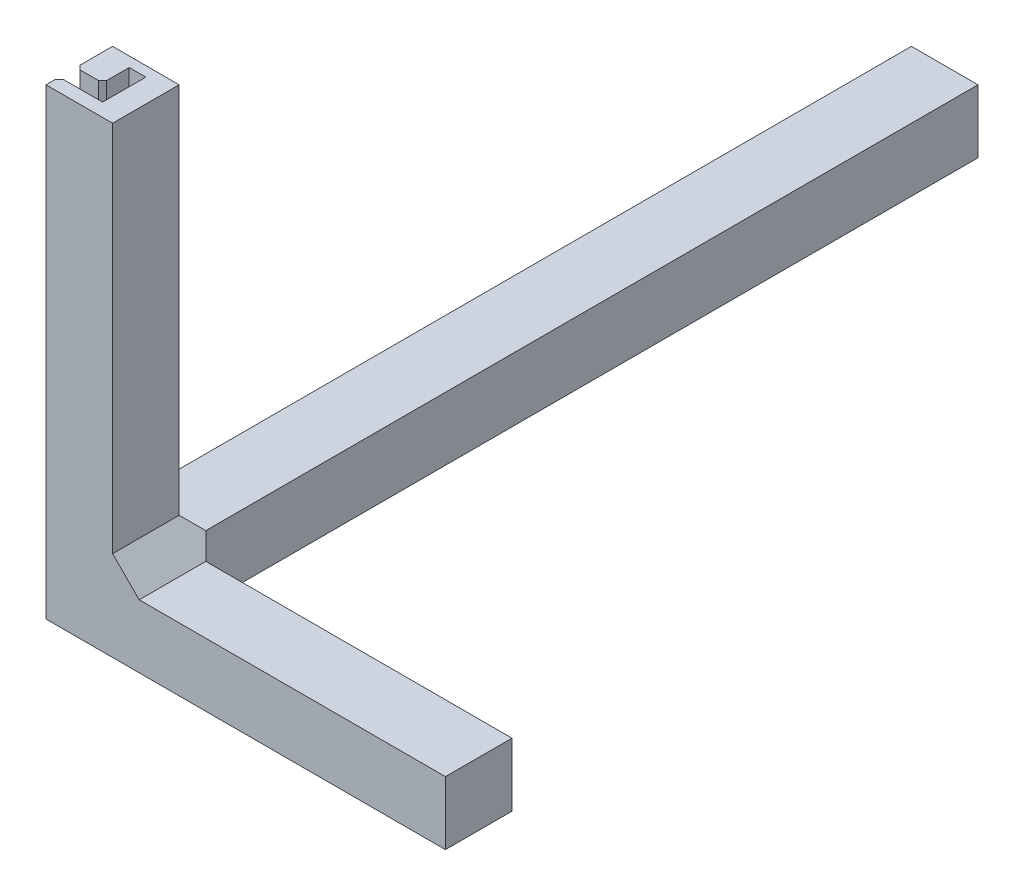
SolidWorks part; units mm, degrees
ref_plane "Plan de face" through (0, 0, 0) normal (0, 0, 1) x (1, 0, 0)
ref_plane "Plan de dessus" through (0, 0, 0) normal (0, 1, 0) x (1, 0, 0)
ref_plane "Plan de droite" through (0, 0, 0) normal (1, 0, 0) x (0, 0, -1)
sketch "Esquisse1" plane through (0, 0, 0) normal (1, 0, 0) x (0, 0, -1)
  line L0 (0, 0) -> (0, 70)
  line L1 (0, 70) -> (10, 70)
  line L2 (10, 70) -> (10, 10)
  line L3 (10, 10) -> (130, 10)
  line L4 (130, 10) -> (130, 0)
  line L5 (130, 0) -> (0, 0)
  dimension "D1" = 10
  dimension "D2" = 130
  dimension "D3" = 70
extrude "Boss.-Extru.1" add sketch "Esquisse1" against normal blind 10
sketch "Esquisse3" plane through (0, 0, 0) normal (1, 0, 0) x (0, 0, -1)
  line L1 (0, 0) -> (10, 0)
  line L2 (0, 0) -> (0, 10)
  line L3 (0, 10) -> (10, 10)
  line L4 (10, 0) -> (10, 10)
extrude "Boss.-Extru.2" add sketch "Esquisse3" along normal blind 50
chamfer "Chanfrein1" distance 4 angle 45 1 edges at (0, 5, -10)
chamfer "Chanfrein2" distance 4 angle 45 2 edges at (-5, 10, -10) (0, 10, -5)
chamfer "Chanfrein4" distance 0.5 angle 45 7 edges at (-5, 0, -130) (-10, 0, -65) (20, 0, 0) (50, 0, -5) (27, 0, -10) (2, 0, -12) (0, 0, -72)
sketch "Esquisse4" plane through (0, 70, 0) normal (0, 1, 0) x (1, 0, 0)
  line L8 (-10, 2) -> (-3.5, 2)
  line L9 (-10, 10) -> (-10, 0) construction
  line L10 (-3.5, 2) -> (-3.5, 8.5)
  line L11 (-3.5, 8.5) -> (-6, 8.5)
  line L12 (-6, 8.5) -> (-6, 4.5)
  line L13 (-6, 4.5) -> (-10, 4.5)
  line L14 (-10, 4.5) -> (-10, 2)
  line L15 (-10, 0) -> (0, 0) construction
  dimension "D1" = 2.5
  dimension "D2" = 2
  dimension "D3" = 4
extrude "Enlèv. mat.-Extru.1" cut sketch "Esquisse4" against normal blind 20
chamfer "Chanfrein5" distance 0.6 angle 45 3 edges at (-10, 60, -2) (-10, 60, -4.5) (-6, 60, -4.5)
